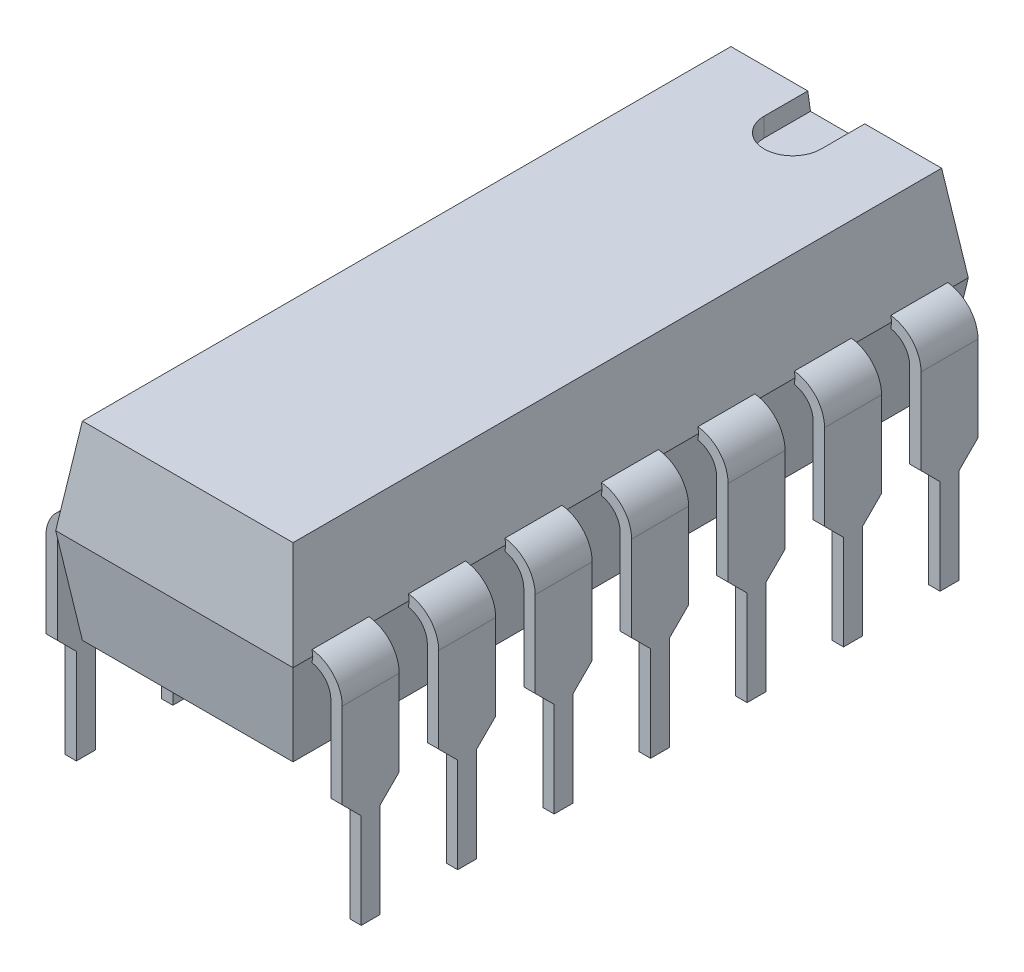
SolidWorks part; units mm, degrees
ref_plane "Front" through (0, 0, 0) normal (0, 0, 1) x (1, 0, 0)
ref_plane "Top" through (0, 0, 0) normal (0, 1, 0) x (1, 0, 0)
ref_plane "Right" through (0, 0, 0) normal (1, 0, 0) x (0, 0, -1)
sketch "Эскиз10" plane through (0, 0, 0) normal (0, 0, 1) x (1, 0, 0)
  line L21 (0, -2.5) -> (0, 2.75) construction
  line L22 (0.75, 3.5) -> (6.75, 3.5) construction
  line L23 (3.75, 3.5) -> (3.75, -2.5) construction
  line L24 (7.5, -2.5) -> (7.5, 2.75) construction
  line L25 (0.15, -2.5) -> (0.15, 2.75)
  line L26 (0.75, 3.35) -> (6.75, 3.35)
  line L27 (7.35, -2.5) -> (7.35, 2.75)
  line L28 (-0.15, -2.5) -> (-0.15, 2.75)
  line L29 (0.75, 3.65) -> (6.75, 3.65)
  line L30 (7.65, -2.5) -> (7.65, 2.75)
  line L31 (-0.15, -2.5) -> (0.15, -2.5)
  line L32 (7.35, -2.5) -> (7.65, -2.5)
  arc A8 (0, 2.75) -> (0.75, 3.5) centre (0.75, 2.75) cw construction
  arc A9 (7.5, 2.75) -> (6.75, 3.5) centre (6.75, 2.75) ccw construction
  arc A10 (0.15, 2.75) -> (0.75, 3.35) centre (0.75, 2.75) cw
  arc A11 (7.35, 2.75) -> (6.75, 3.35) centre (6.75, 2.75) ccw
  arc A12 (-0.15, 2.75) -> (0.75, 3.65) centre (0.75, 2.75) cw
  arc A13 (7.65, 2.75) -> (6.75, 3.65) centre (6.75, 2.75) ccw
  dimension "D2" = 2.5
  dimension "D5" = 0.75
  dimension "D1" = 6
  dimension "A" = 7.5
  dimension "D6" = 0.15
  dimension "D7" = 0.15
extrude "Вытянуть1" add sketch "Эскиз10" along normal mid plane 1.5
sketch "Эскиз11" plane through (7.65, 0, 0) normal (1, 0, 0) x (0, 0, -1)
  line L0 (-0.75, 0.5) -> (-0.25, 0)
  line L1 (-0.75, -2.5) -> (-0.75, 2.75) construction
  line L2 (-0.25, 0) -> (-0.25, -2.5)
  line L3 (-0.75, -2.5) -> (0.75, -2.5) construction
  line L4 (-0.25, -2.5) -> (-0.75, -2.5)
  line L5 (-0.75, -2.5) -> (-0.75, 0.5)
  line L6 (0, 0) -> (0, -2.5) construction
  line L7 (0.75, -2.5) -> (0.75, 0.5)
  line L8 (0.25, -2.5) -> (0.75, -2.5)
  line L9 (0.25, 0) -> (0.25, -2.5)
  line L10 (0.75, 0.5) -> (0.25, 0)
  dimension "D1" = 0.5
  dimension "D2" = 45
extrude "Вырез-Вытянуть1" cut sketch "Эскиз11" against normal through all
ref_plane "Плоскость1" through (0, 3.5, 0) normal (0, 1, 0) x (-1, 0, 0)
sketch "Эскиз1" plane through (0, 3.5, 0) normal (0, 1, 0) x (1, 0, 0)
  line L0 (3.75, 1.27) -> (3.75, -16.51) construction
  line L1 (0.625, -16.51) -> (6.875, -16.51)
  line L2 (0.625, -16.51) -> (0.625, 1.27)
  line L3 (0.625, 1.27) -> (6.875, 1.27)
  line L4 (6.875, -16.51) -> (6.875, 1.27)
  line L6 (0.75, -0.75) -> (0.75, 0.75) construction
  line L7 (6.75, -0.75) -> (6.75, 0.75) construction
  dimension "D1" = 1.27
  dimension "L" = 17.78
  dimension "W" = 6.25
extrude "Вытянуть2" add sketch "Эскиз1" along normal mid plane 5 draft 8
sketch "Эскиз12" plane through (0, 6, 0) normal (0, 1, 0) x (-1, 0, 0)
  line L0 (-3, -1.27) -> (-3, 0.23)
  line L1 (-6.875, -1.27) -> (-0.625, -1.27) construction
  line L2 (-4.5, 0.23) -> (-4.5, -1.27)
  line L3 (-4.5, -1.27) -> (-3, -1.27)
  line L4 (-3.75, 0.23) -> (-3.75, -1.27) construction
  arc A0 (-3, 0.23) -> (-4.5, 0.23) centre (-3.75, 0.23) ccw
  dimension "D1" = 1.5
  dimension "D2" = 1.5
extrude "Вырез-Вытянуть2" cut sketch "Эскиз12" against normal blind 0.5
pattern_linear "Линейный массив1" count 7 spacing 2.54 along (0, 0, 1) of "Вырез-Вытянуть1", "Вытянуть1"
